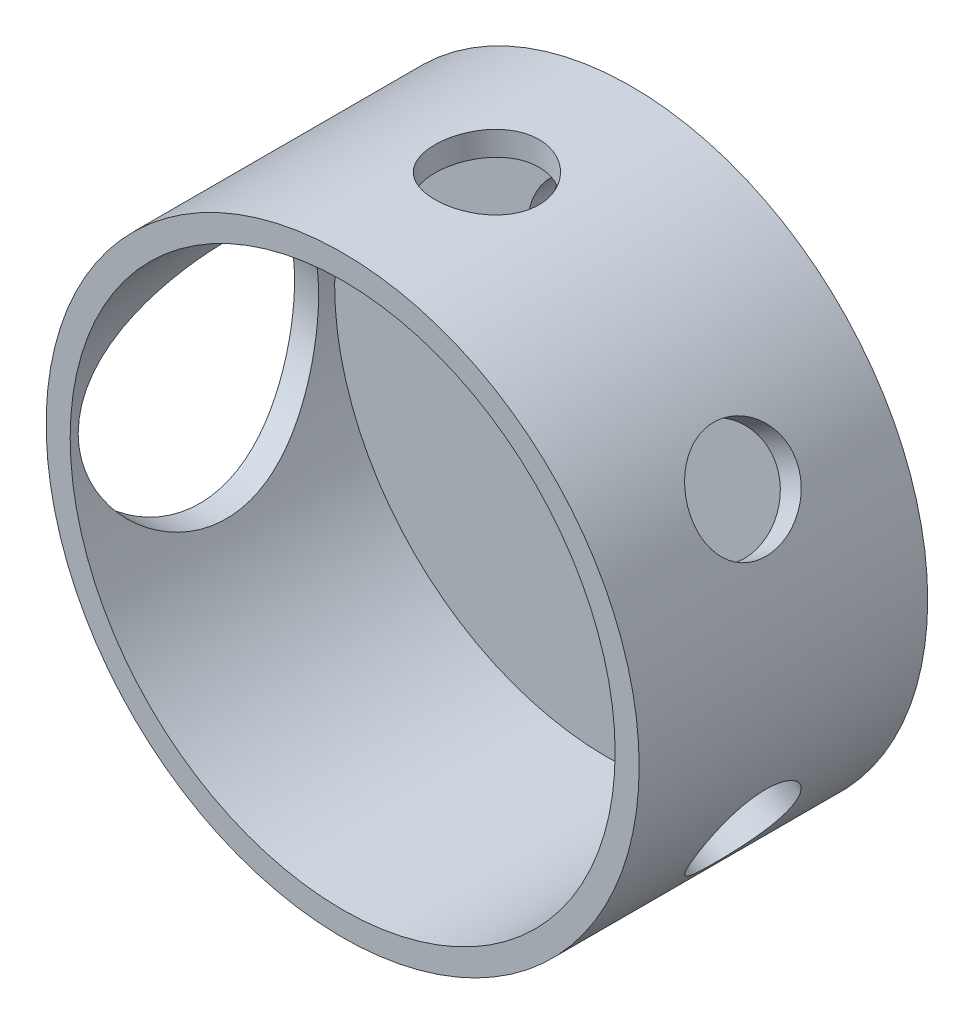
SolidWorks part; units mm, degrees
ref_plane "Plan de face" through (0, 0, 0) normal (0, 0, 1) x (1, 0, 0)
ref_plane "Plan de dessus" through (0, 0, 0) normal (0, 1, 0) x (1, 0, 0)
ref_plane "Plan de droite" through (0, 0, 0) normal (1, 0, 0) x (0, 0, -1)
sketch "Esquisse1" plane through (0, 0, 0) normal (0, 0, 1) x (1, 0, 0)
  circle A0 centre (0, 0) radius 37
  dimension "D1" = 74
extrude "Extrusion1" add sketch "Esquisse1" along normal blind 3
sketch "Esquisse2" plane through (0, 0, 3) normal (0, 0, 1) x (1, 0, 0)
  circle A0 centre (0, 0) radius 34
  dimension "D1" = 68
extrude "Extru.-Mince1" add sketch "Esquisse2" along normal blind 33 thin
hole_wizard "Trou taraudé M51" positions "Esquisse7" profile "Esquisse6" tap size "M5" standard "ISO"
sketch "Esquisse7" plane through (0, 0, 3) normal (0, 0, 1) x (1, 0, 0)
  line L0 (0, 22.9607) -> (0, -20.7961) construction
  line L2 (-19.4045, 0) -> (22.033, 0) construction
  line L4 (-19.4045, -17) -> (22.033, -17) construction
  point P0 (0, -17)
  dimension "D1" = 17
sketch "Esquisse6" plane through (0, -17, 3) normal (1, 0, 0) x (0, -1, 0)
  line L0 (0, 0) -> (0, 15.2618)
  line L1 (0, 15.2618) -> (2.1, 14)
  line L2 (2.1, 14) -> (2.1, 0)
  line L5 (2.1, 0) -> (0, 0)
  line L10 (0, 15.2618) -> (-2.1, 14) construction
  line L11 (0, -6.35) -> (0, 107.95) construction
  dimension "Diamètre du trou pour taraudage" = 4.2
  dimension "Profondeur du trou pour taraudage" = 14
  dimension "Angle de pointe" = 118
sketch "Esquisse9" plane through (0, 0, 0) normal (0, 0, -1) x (-1, 0, 0)
  line L0 (0, 35.4755) -> (0, -29.6903) construction
  line L1 (-15.1468, 0) -> (27.3238, 0) construction
  circle A0 centre (0, 18) radius 10
  circle A1 centre (0, 0) radius 37 construction
  dimension "D1" = 20
  dimension "D2" = 18
extrude "Extrusion3" cut sketch "Esquisse9" against normal blind 10
ref_plane "Plan2" through (-37, 0, 0) normal (1, 0, 0) x (0, 0, -1)
sketch "Esquisse10" plane through (-37, 0, 0) normal (1, 0, 0) x (0, 0, -1)
  line L0 (0, -37) -> (0, 37) construction
  line L1 (8.3949, 0) -> (-27.117, 0) construction
  circle A0 centre (-20, 0) radius 15
  dimension "D1" = 30
  dimension "D2" = 20
extrude "Extrusion4" cut sketch "Esquisse10" along normal blind 10
sketch "Esquisse11" plane through (0, 0, 0) normal (0, 1, 0) x (1, 0, 0)
  line L0 (10, 0) -> (-10, 0) construction
  circle A0 centre (0, -18) radius 6.5
  dimension "D1" = 13
  dimension "D2" = 18
extrude "Extrusion5" cut sketch "Esquisse11" along normal through all
pattern_circular "Répétition circulaire1" count 3 every 60 about axis through (0, 0, 3) along (0, 0, -1) of "Extrusion5"
